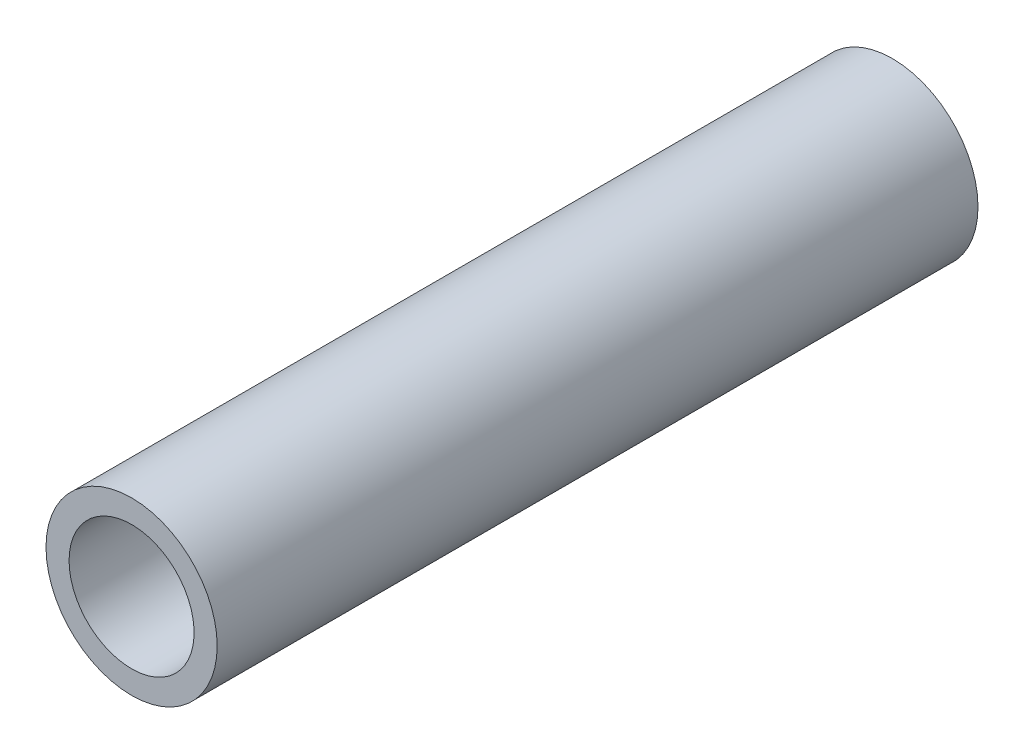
SolidWorks part; units mm, degrees
ref_plane "Front Plane" through (0, 0, 0) normal (0, 0, 1) x (1, 0, 0)
ref_plane "Top Plane" through (0, 0, 0) normal (0, 1, 0) x (1, 0, 0)
ref_plane "Right Plane" through (0, 0, 0) normal (1, 0, 0) x (0, 0, -1)
sketch "Sketch1" plane through (0, 0, 0) normal (0, 0, 1) x (1, 0, 0)
  circle A0 centre (0, 0) radius 8.5725
  circle A1 centre (0, 0) radius 6.2611
  dimension "D1" = 17.145
  dimension "D2" = 2.3114
extrude "Extrude1" add sketch "Sketch1" along normal blind 76.2
